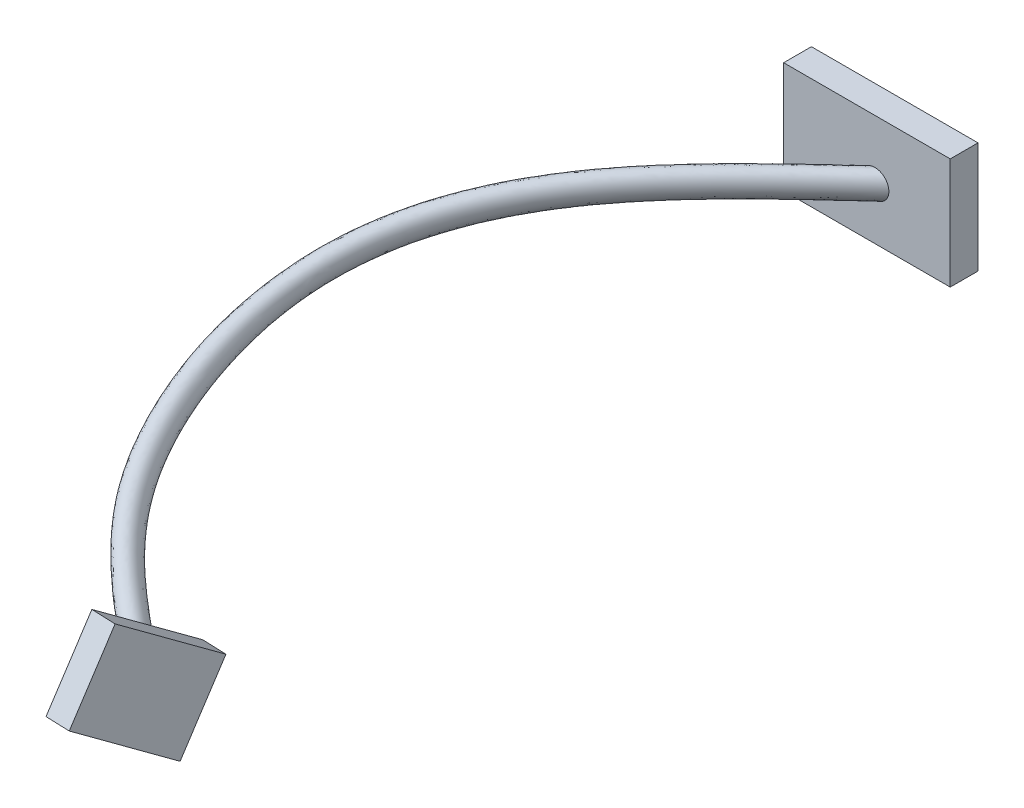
SolidWorks part; units mm, degrees
ref_plane "Front" through (0, 0, 0) normal (0, 0, 1) x (1, 0, 0)
ref_plane "Top" through (0, 0, 0) normal (0, 1, 0) x (1, 0, 0)
ref_plane "Right" through (0, 0, 0) normal (1, 0, 0) x (0, 0, -1)
sketch "Sketch1" plane through (0, 0, 0) normal (0, 0, 1) x (1, 0, 0)
  line L1 (-68.4658, -154.4543) -> (-106.5658, -154.4543)
  line L2 (-68.4658, -154.4543) -> (-68.4658, -129.0543)
  line L3 (-68.4658, -129.0543) -> (-106.5658, -129.0543)
  line L4 (-106.5658, -154.4543) -> (-106.5658, -129.0543)
  dimension "D1" = 38.1
  dimension "D2" = 25.4
extrude "Base-Extrude" add sketch "Sketch1" along normal blind 6.35
sketch3d "3DSketch1"
  point P0 (-85.6754, -142.5374, 6.35)
  point P1 (-134.5304, -144.9646, 90.6527)
  point P2 (-125.7776, -164.9787, 136.7923)
  point P3 (-110.4936, -173.6962, 150.354)
sketch "Sketch2" plane through (0, 0, 6.35) normal (0, 0, 1) x (1, 0, 0)
  circle A0 centre (-85.6754, -142.5374) radius 3.175
  dimension "D1" = 6.35
sweep "Boss-Sweep1" add profiles "Sketch2" path "3DSketch1"
sketch "Sketch3" plane through (-104.4764, -12.0255, -15.5116) normal (0.9828, 0.1131, 0.1459) x (0.1843, -0.551, -0.8139)
  line L1 (-33.6943, -223.7013) -> (-59.0943, -223.7013)
  line L2 (-33.6943, -223.7013) -> (-33.6943, -242.7513)
  line L3 (-33.6943, -242.7513) -> (-59.0943, -242.7513)
  line L4 (-59.0943, -223.7013) -> (-59.0943, -242.7513)
  circle A0 centre (-47.0331, -226.8763) radius 3.175 construction
  dimension "D1" = 25.4
  dimension "D2" = 19.05
extrude "Boss-Extrude1" add sketch "Sketch3" along normal blind 6.35
